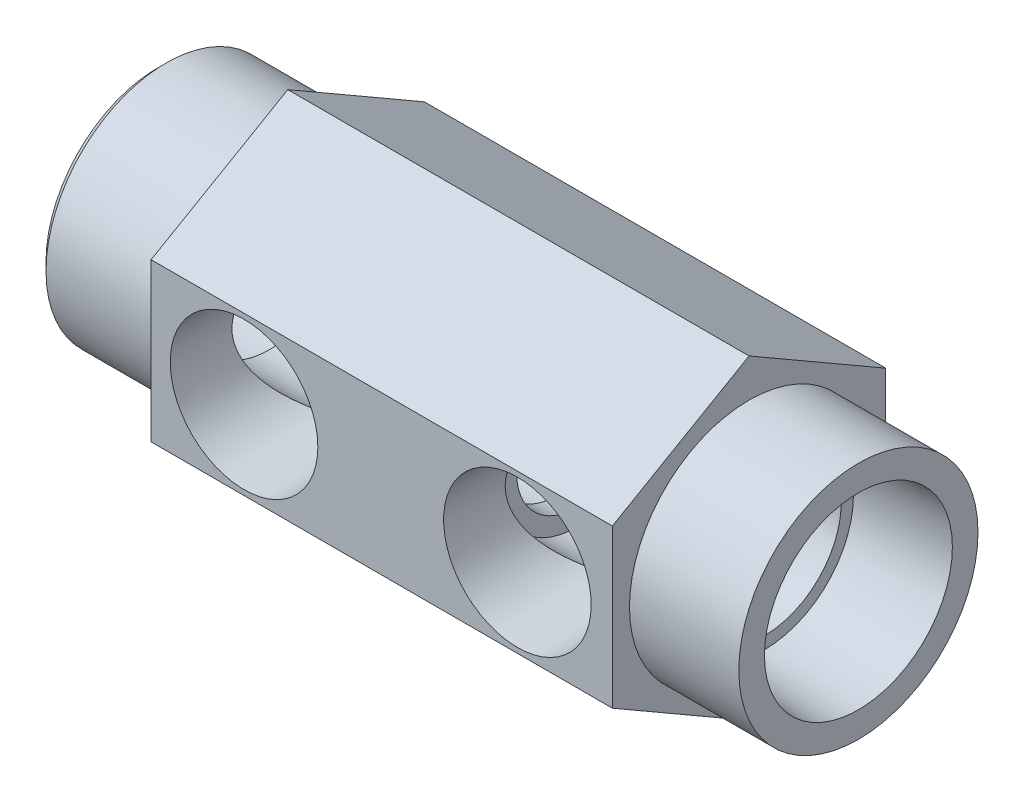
SolidWorks part; units mm, degrees
ref_plane "Front Plane" through (0, 0, 0) normal (0, 0, 1) x (1, 0, 0)
ref_plane "Top Plane" through (0, 0, 0) normal (0, 1, 0) x (1, 0, 0)
ref_plane "Right Plane" through (0, 0, 0) normal (1, 0, 0) x (0, 0, -1)
sketch "Sketch1" plane through (0, 0, 0) normal (1, 0, 0) x (0, 0, -1)
  line L0 (0, 16.1312) -> (0, -16.1312) construction
  line L1 (12.7, 7.3323) -> (0, 14.6647)
  line L2 (0, 14.6647) -> (-12.7, 7.3323)
  line L3 (-12.7, 7.3323) -> (-12.7, -7.3323)
  line L4 (-12.7, -7.3323) -> (0, -14.6647)
  line L5 (0, -14.6647) -> (12.7, -7.3323)
  line L6 (12.7, -7.3323) -> (12.7, 7.3323)
  circle A0 centre (0, 0) radius 12.7 construction
  dimension "D1" = 25.4
extrude "Boss-Extrude1" add sketch "Sketch1" along normal blind 42.8625 separate body
sketch "Sketch2" plane through (0, 0, 0) normal (-1, 0, 0) x (0, 0, 1)
  circle A1 centre (0, 0) radius 11.1125
  dimension "D1" = 22.225
extrude "Boss-Extrude2" add sketch "Sketch2" against normal blind 53.0225
sketch "Sketch3" plane through (0, 0, 0) normal (0, 1, 0) x (1, 0, 0)
  line L2 (44.2849, 7.1437) -> (44.2849, 8.2733)
  line L3 (44.2849, 7.1437) -> (26.8287, 7.1437)
  line L4 (26.8287, 7.1437) -> (26.8287, 0)
  line L5 (53.0225, -11.1125) -> (53.0225, 11.1125) construction
  line L6 (53.0225, 0) -> (53.0225, 8.7313)
  line L7 (44.2849, 8.2733) -> (53.0225, 8.7313)
  line L8 (0, 0) -> (50000, 0) construction
  line L9 (26.8287, 0) -> (53.0225, 0)
  dimension "D1" = 3
  dimension "D2" = 17.4625
  dimension "D3" = 8.7376
  dimension "D4" = 14.2875
  dimension "D5" = 26.1937
revolve "Cut-Revolve1" cut sketch "Sketch3" angle 360 about L8
hole_wizard "1/4 NPT Tapped Hole1" positions "Sketch5" profile "Sketch4" size "1/4" standard "Ansi Inch"
sketch "Sketch5" plane through (0, 0, 12.7) normal (0, 0, 1) x (1, 0, 0)
  line L0 (13.97, 0) -> (-13.97, 0) construction
  line L1 (0, -13.97) -> (0, 13.97) construction
  point P0 (8.636, 0)
  point P1 (34.036, 0)
  dimension "D1" = 8.636
  dimension "D2" = 25.4
sketch "Sketch4" plane through (8.636, 0, 12.7) normal (1, 0, 0) x (0, -1, 0)
  line L0 (0, 0) -> (0, 19.2173)
  line L1 (5.5626, 15.875) -> (0, 19.2173)
  line L2 (-5.5626, 15.875) -> (0, 19.2173) construction
  line L3 (5.5626, 15.875) -> (5.5626, 10.0203)
  line L4 (5.5626, 10.0203) -> (6.558, 10.0203)
  line L5 (6.558, 10.0203) -> (6.858, 0)
  line L6 (-6.558, 10.0203) -> (-6.858, 0) construction
  line L7 (6.858, 0) -> (0, 0)
  line L8 (0, -6.35) -> (0, 107.95) construction
  line L11 (-5.5626, 10.0203) -> (-6.558, 10.0203) construction
  dimension "Tap Drill Dia." = 11.1252
  dimension "Tap Drill Depth" = 15.875
  dimension "Thread Dia." = 13.716
  dimension "Thread Angle" = 3.43
  dimension "Thread Depth" = 10.0203
  dimension "Drill Angle" = 118
hole_wizard "1/4 NPT Tapped Hole2" positions "Sketch7" profile "Sketch6" size "1/4" standard "Ansi Inch"
sketch "Sketch7" plane through (0, 0, -12.7) normal (0, 0, -1) x (-1, 0, 0)
  circle A0 centre (-8.636, 0) radius 6.858 construction
  point P0 (-8.636, 0)
sketch "Sketch6" plane through (8.636, 0, -12.7) normal (1, 0, 0) x (0, 1, 0)
  line L0 (0, 0) -> (0, 20.4111)
  line L1 (5.5626, 17.0688) -> (0, 20.4111)
  line L2 (-5.5626, 17.0688) -> (0, 20.4111) construction
  line L3 (5.5626, 17.0688) -> (5.5626, 10.0203)
  line L4 (5.5626, 10.0203) -> (6.558, 10.0203)
  line L5 (6.558, 10.0203) -> (6.858, 0)
  line L6 (-6.558, 10.0203) -> (-6.858, 0) construction
  line L7 (6.858, 0) -> (0, 0)
  line L8 (0, -6.35) -> (0, 107.95) construction
  line L11 (-5.5626, 10.0203) -> (-6.558, 10.0203) construction
  dimension "Tap Drill Dia." = 11.1252
  dimension "Tap Drill Depth" = 17.0688
  dimension "Thread Dia." = 13.716
  dimension "Thread Angle" = 3.43
  dimension "Thread Depth" = 10.0203
  dimension "Drill Angle" = 118
sketch "Sketch12" plane through (0, 0, 0) normal (-1, 0, 0) x (0, 0, 1)
  circle A0 centre (0, 0) radius 11.176
  dimension "D1" = 22.352
extrude "Boss-Extrude3" add sketch "Sketch12" along normal offset from surface (12.0523 mm away) 65.0748
fillet "Fillet1" radius 0.762 1 edges at (0, 0, 11.176)
chamfer "Chamfer1" distance 0.762 angle 45 1 edges at (-12.0523, 0, 11.176)
hole_wizard "3/8 NPT Tapped Hole1" positions "Sketch13" profile "Sketch15" size "3/8" standard "ANSI Inch"
sketch "Sketch13" plane through (-12.0523, 0, 0) normal (-1, 0, 0) x (0, 0, 1)
  point P0 (0, 0)
sketch "Sketch15" plane through (-12.0523, 0, 0) normal (0, 1, 0) x (0, 0, 1)
  line L0 (0, 0) -> (0, 26.9748)
  line L1 (7.1374, 26.9748) -> (0, 26.9748)
  line L2 (-7.1374, 26.9748) -> (0, 26.9748) construction
  line L3 (7.1374, 26.9748) -> (7.1374, 10.3302)
  line L4 (7.1374, 10.3302) -> (8.2632, 10.3302)
  line L5 (8.2632, 10.3302) -> (8.5725, 0)
  line L6 (-8.2632, 10.3302) -> (-8.5725, 0) construction
  line L7 (8.5725, 0) -> (0, 0)
  line L8 (0, -6.35) -> (0, 107.95) construction
  line L9 (11.1125, 65.0748) -> (-11.1125, 65.0748) construction
  line L11 (-7.1374, 10.3302) -> (-8.2632, 10.3302) construction
  dimension "Tap Drill Dia." = 14.2748
  dimension "Tap Drill Depth" = 26.9748
  dimension "Thread Dia." = 17.145
  dimension "Thread Angle" = 3.43
  dimension "Thread Depth" = 10.3302
  dimension "Drill Angle" = 180
hole_wizard "1/4 NPT Tapped Hole3" positions "Sketch16" profile "Sketch18" size "1/4" standard "ANSI Inch"
sketch "Sketch16" plane through (14.9225, 0, 0) normal (-1, 0, 0) x (0, 0, 1)
  point P0 (0, 0)
sketch "Sketch18" plane through (14.9225, 0, 0) normal (0, 1, 0) x (0, 0, 1)
  line L0 (0, 0) -> (0, 38.1)
  line L1 (0, 38.1) -> (5.5626, 38.1)
  line L2 (-6.558, 10.0203) -> (-6.858, 0) construction
  line L3 (5.5626, 38.1) -> (5.5626, 10.0203)
  line L4 (5.5626, 10.0203) -> (6.558, 10.0203)
  line L5 (6.558, 10.0203) -> (6.858, 0)
  line L7 (6.858, 0) -> (0, 0)
  line L8 (0, -6.35) -> (0, 107.95) construction
  line L11 (-5.5626, 10.0203) -> (-6.558, 10.0203) construction
  dimension "Thru Tap Drill Dia." = 11.1252
  dimension "Thru Tap Drill Depth" = 38.1
  dimension "Thread Dia." = 13.716
  dimension "Thread Angle" = 3.43
  dimension "Thread Depth" = 10.0203
